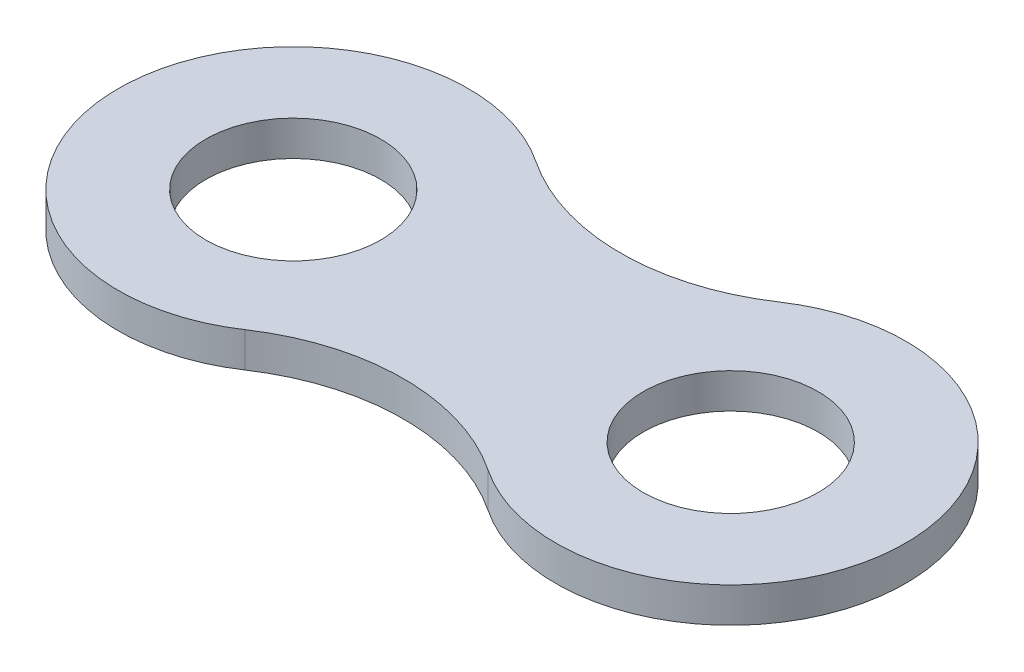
SolidWorks part; units mm, degrees
ref_plane "Front Plane" through (0, 0, 0) normal (0, 0, 1) x (1, 0, 0)
ref_plane "Top Plane" through (0, 0, 0) normal (0, 1, 0) x (1, 0, 0)
ref_plane "Right Plane" through (0, 0, 0) normal (1, 0, 0) x (0, 0, -1)
sketch "Sketch1" plane through (0, 0, 0) normal (0, 1, 0) x (1, 0, 0)
  arc A0 (2.8222, 4.2239) -> (2.8222, -4.2239) centre (0, 0) ccw
  arc A1 (9.8778, 4.2239) -> (9.8778, -4.2239) centre (12.7, 0) cw
  arc A2 (2.8222, 4.2239) -> (9.8778, 4.2239) centre (6.35, 9.5038) ccw
  arc A3 (9.8778, -4.2239) -> (2.8222, -4.2239) centre (6.35, -9.5038) ccw
  dimension "D1" = 12.7
  dimension "D2" = 6.35
  dimension "D3" = 5.08
extrude "Extrude1" add sketch "Sketch1" along normal blind 1.016
other "Hole1"
sketch "Sketch2" plane through (0, 1.016, 0) normal (0, 1, 0) x (-1, 0, 0)
  circle A0 centre (0, 0) radius 2.54
  arc A1 (-2.8222, -4.2239) -> (-2.8222, 4.2239) centre (0, 0) ccw construction
  dimension "D1" = 5.08
other "Hole2"
sketch "Sketch3" plane through (0, 1.016, 0) normal (0, 1, 0) x (-1, 0, 0)
  circle A0 centre (-12.7, 0) radius 2.54
  arc A1 (-9.8778, 4.2239) -> (-9.8778, -4.2239) centre (-12.7, 0) ccw construction
  dimension "D1" = 5.08
